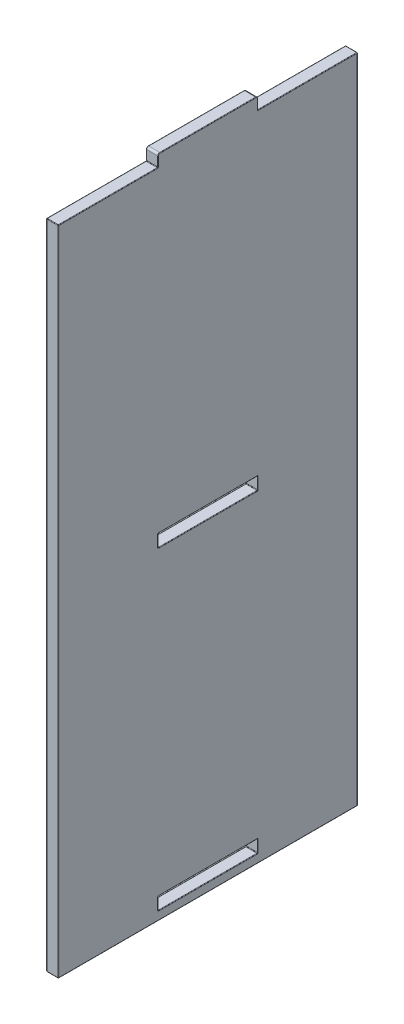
SolidWorks part; units mm, degrees
ref_plane "Front Plane" through (0, 0, 0) normal (0, 0, 1) x (1, 0, 0)
ref_plane "Top Plane" through (0, 0, 0) normal (0, 1, 0) x (1, 0, 0)
ref_plane "Right Plane" through (0, 0, 0) normal (1, 0, 0) x (0, 0, -1)
sketch "Sketch1" plane through (0, 0, 0) normal (1, 0, 0) x (0, 0, -1)
  line L0 (-370.0066, 0) -> (517.029, 0) construction
  line L1 (-150, 327) -> (-50, 327)
  line L2 (-150, 327) -> (-150, -327)
  line L3 (-150, -327) -> (150, -327)
  line L4 (150, 327) -> (150, -327)
  line L5 (-150, 327) -> (150, -327) construction
  line L6 (-150, -327) -> (150, 327) construction
  line L7 (0, 491.3001) -> (0, 339) construction
  line L8 (-281.268, 3) -> (408.6731, 3) construction
  line L9 (-190.1027, -312) -> (201.1326, -312) construction
  line L10 (-50, 9.25) -> (50, 9.25)
  line L11 (-50, 9.25) -> (-50, -3.25)
  line L12 (-50, -3.25) -> (50, -3.25)
  line L13 (50, 9.25) -> (50, -3.25)
  line L14 (-50, 9.25) -> (50, -3.25) construction
  line L15 (-50, -3.25) -> (50, 9.25) construction
  line L16 (-110.1887, 339) -> (91.9834, 339) construction
  line L17 (-50, -305.75) -> (50, -305.75)
  line L18 (-50, -305.75) -> (-50, -318.25)
  line L19 (-50, -318.25) -> (50, -318.25)
  line L20 (50, -305.75) -> (50, -318.25)
  line L21 (-50, -305.75) -> (50, -318.25) construction
  line L22 (-50, -318.25) -> (50, -305.75) construction
  line L23 (-50, 339) -> (-50, 327)
  line L24 (50, 339) -> (50, 327)
  line L25 (-50, 339) -> (50, 339)
  line L26 (50, 327) -> (150, 327)
  line L27 (0, 327) -> (0, -501.1016) construction
  point P0 (0, 0)
  point P12 (0, 3)
  point P19 (0, -312)
  dimension "D1" = 654
  dimension "D2" = 300
  dimension "D3" = 330
  dimension "D4" = 100
  dimension "D5" = 12.5
  dimension "D6" = 15
  dimension "D7" = 100
  dimension "D8" = 12.5
  dimension "D9" = 12
  dimension "D10" = 50
extrude "Boss-Extrude1" add sketch "Sketch1" along normal blind 12
fillet "Fillet1" radius 2 2 edges at (6, 339, -50) (6, 339, 50)
fillet "Fillet2" radius 0.5 50 edges at (0, 339, 0) (0, 338.4142, -49.4142) (0, 338.4142, 49.4142) (0, 332, -50) (0, 332, 50) (6, 9.25, 50) (6, 9.25, -50) (6, -3.25, -50) (6, -3.25, 50) (6, -318.25, -50) (6, -318.25, 50) (6, -305.75, 50) (6, -305.75, -50) (0, -327, 0) (6, -327, 150) (0, 0, 150) (0, -318.25, 0) (0, -312, 50) (0, -305.75, 0) (0, -312, -50) (0, -3.25, 0) (0, 3, 50) (0, 9.25, 0) (0, 3, -50) (12, -312, 50) (12, -318.25, 0) (12, -312, -50) (12, -305.75, 0) (12, 3, 50) (12, -3.25, 0) (12, 3, -50) (12, 9.25, 0) (12, -327, 0) (12, 0, 150) (12, 332, 50) (12, 338.4142, 49.4142) (12, 339, 0) (12, 338.4142, -49.4142) (12, 332, -50) (6, -327, -150) (12, 0, -150) (0, 0, -150) (6, 327, -150) (12, 327, -100) (6, 327, -50) (0, 327, -100) (6, 327, 50) (12, 327, 100) (6, 327, 150) (0, 327, 100)
